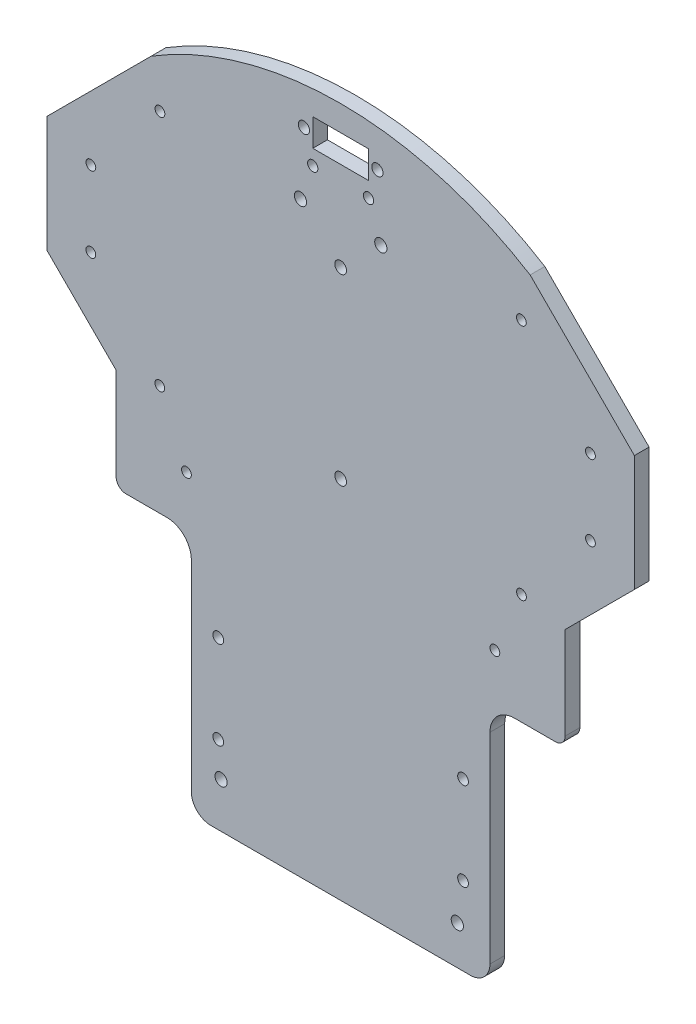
SolidWorks part; units mm, degrees
ref_plane "Plan de face" through (0, 0, 0) normal (0, 0, 1) x (1, 0, 0)
ref_plane "Plan de dessus" through (0, 0, 0) normal (0, 1, 0) x (1, 0, 0)
ref_plane "Plan de droite" through (0, 0, 0) normal (1, 0, 0) x (0, 0, -1)
sketch "Esquisse1" plane through (0, 0, 0) normal (0, 0, 1) x (1, 0, 0)
  line L0 (0, -20.5921) -> (0, 113.1079) construction
  line L1 (-26.5, -20.5921) -> (26.5, -20.5921)
  line L2 (45.8579, 31.4079) -> (45.8579, 50.2658)
  line L3 (45.8579, 50.2658) -> (60, 64.4079)
  line L4 (60, 64.4079) -> (60, 88.1079)
  line L5 (30.5, -16.5921) -> (30.5, 24.4079)
  line L6 (38.7, 109.4079) -> (60, 88.1079)
  line L7 (-35.5, 29.4079) -> (-43.8579, 29.4079)
  line L8 (-30.5, -16.5921) -> (-30.5, 24.4079)
  line L9 (-38.7, 109.4079) -> (-60, 88.1079)
  line L10 (-45.8579, 31.4079) -> (-45.8579, 50.2658)
  line L11 (-13.0881, 99.4079) -> (16.5602, 99.4079) construction
  line L12 (25, -20.5921) -> (25, 11.3266) construction
  line L13 (7.9171, 4.4079) -> (21.2004, 4.4079) construction
  line L14 (-45.8579, 50.2658) -> (-60, 64.4079)
  line L15 (-38.7, 109.4079) -> (38.7, 109.4079)
  line L16 (-60, 64.4079) -> (-60, 88.1079)
  line L17 (35.5, 29.4079) -> (43.8579, 29.4079)
  arc A0 (30.5, -16.5921) -> (26.5, -20.5921) centre (26.5, -16.5921) cw
  arc A1 (35.5, 29.4079) -> (30.5, 24.4079) centre (35.5, 24.4079) ccw
  arc A2 (43.8579, 29.4079) -> (45.8579, 31.4079) centre (43.8579, 31.4079) ccw
  circle A3 centre (0, 91.4079) radius 1.2
  circle A4 centre (0, 54.0079) radius 1.2
  arc A7 (-43.8579, 29.4079) -> (-45.8579, 31.4079) centre (-43.8579, 31.4079) cw
  arc A8 (-35.5, 29.4079) -> (-30.5, 24.4079) centre (-35.5, 24.4079) cw
  arc A9 (-30.5, -16.5921) -> (-26.5, -20.5921) centre (-26.5, -16.5921) ccw
  circle A10 centre (8.2, 99.4079) radius 1.25
  circle A11 centre (-8.2, 99.4079) radius 1.25
  circle A12 centre (25, -4.5921) radius 1.1
  circle A13 centre (25, 13.4079) radius 1.1
  circle A14 centre (-25, -4.5921) radius 1.1
  circle A15 centre (-25, 13.4079) radius 1.1
  circle A16 centre (-31.5, 39.4079) radius 1
  circle A17 centre (31.5, 39.4079) radius 1
  circle A18 centre (-24.43, -11.3921) radius 1.25
  circle A19 centre (23.83, -12.6621) radius 1.25
  dimension "D1" = 4
  dimension "D2" = 5
  dimension "D5" = 50
  dimension "D6" = 10
  dimension "D10" = 2.5
  dimension "D14" = 9
  dimension "D16" = 10
  dimension "D17" = 24.43
  dimension "D18" = 2.4
  dimension "D21" = 9.2
  dimension "D22" = 23.83
  dimension "D23" = 2.5
  dimension "D24" = 7.93
  dimension "D25" = 2.4
  dimension "D26" = 60
  dimension "D19" = 18
  dimension "D20" = 2.5
  dimension "D27" = 20
  dimension "D15" = 31.5
  dimension "D30" = 2.2
  dimension "D3" = 45
  dimension "D4" = 30.5
  dimension "D7" = 35
  dimension "D8" = 23.7
  dimension "D9" = 45
  dimension "D11" = 8.2
  dimension "D12" = 25
  dimension "D13" = 25
  dimension "D28" = 37.4
  dimension "D29" = 45
extrude "Extrusion1" add sketch "Esquisse1" along normal blind 3
ref_plane "Plan1" through (0, 0, 0.75) normal (0, 0, 1) x (1, 0, 0)
sketch "Esquisse5" plane through (0, 0, 3) normal (0, 0, 1) x (1, 0, 0)
  line L0 (60, 88.1079) -> (38.7, 109.4079) construction
  line L1 (38.7, 109.4079) -> (-38.7, 109.4079) construction
  line L2 (-38.7, 109.4079) -> (38.7, 109.4079)
  arc A0 (-38.7, 109.4079) -> (38.7, 109.4079) centre (0, 46.6745) cw
extrude "Extrusion2" add sketch "Esquisse5" against normal blind 3
sketch "Esquisse6" plane through (0, 0, 3) normal (0, 0, 1) x (1, 0, 0)
  line L0 (0, -20.5921) -> (0, 117.9147) construction
  line L1 (-26.5, -20.5921) -> (26.5, -20.5921) construction
  line L2 (0, 115.2079) -> (0, 109.6079) construction
  line L3 (-5.7, 115.2079) -> (5.7, 115.2079)
  line L4 (-5.7, 115.2079) -> (-5.7, 109.6079)
  line L5 (-5.7, 109.6079) -> (5.7, 109.6079)
  line L6 (5.7, 115.2079) -> (5.7, 109.6079)
  line L7 (5.7, 112.4079) -> (15.7033, 112.4079) construction
  line L8 (0, 106.5079) -> (5.7, 106.5079) construction
  circle A0 centre (-36.914, 100.5444) radius 1
  circle A1 centre (-51.0227, 83.989) radius 1
  circle A2 centre (-51.0227, 68.5644) radius 1
  circle A3 centre (-36.9378, 51.9952) radius 1
  circle A4 centre (36.9378, 51.9952) radius 1
  circle A5 centre (51.0227, 68.5644) radius 1
  circle A6 centre (51.0227, 83.989) radius 1
  circle A7 centre (36.914, 100.5444) radius 1
  circle A8 centre (7.5, 112.4079) radius 1.15
  circle A9 centre (-7.5, 112.4079) radius 1.15
  circle A10 centre (8.2, 99.4079) radius 1.25 construction
  circle A12 centre (5.7, 106.5079) radius 1.05
  circle A13 centre (-5.7, 106.5079) radius 1.05
  dimension "D1" = 2
  dimension "D4" = 7.5
  dimension "D5" = 2.3
  dimension "D6" = 13
  dimension "D7" = 2.1
  dimension "D2" = 11.4
  dimension "D3" = 5.6
  dimension "D8" = 3.1
extrude "Enlèv. mat.-Extru.1" cut sketch "Esquisse6" against normal through all
